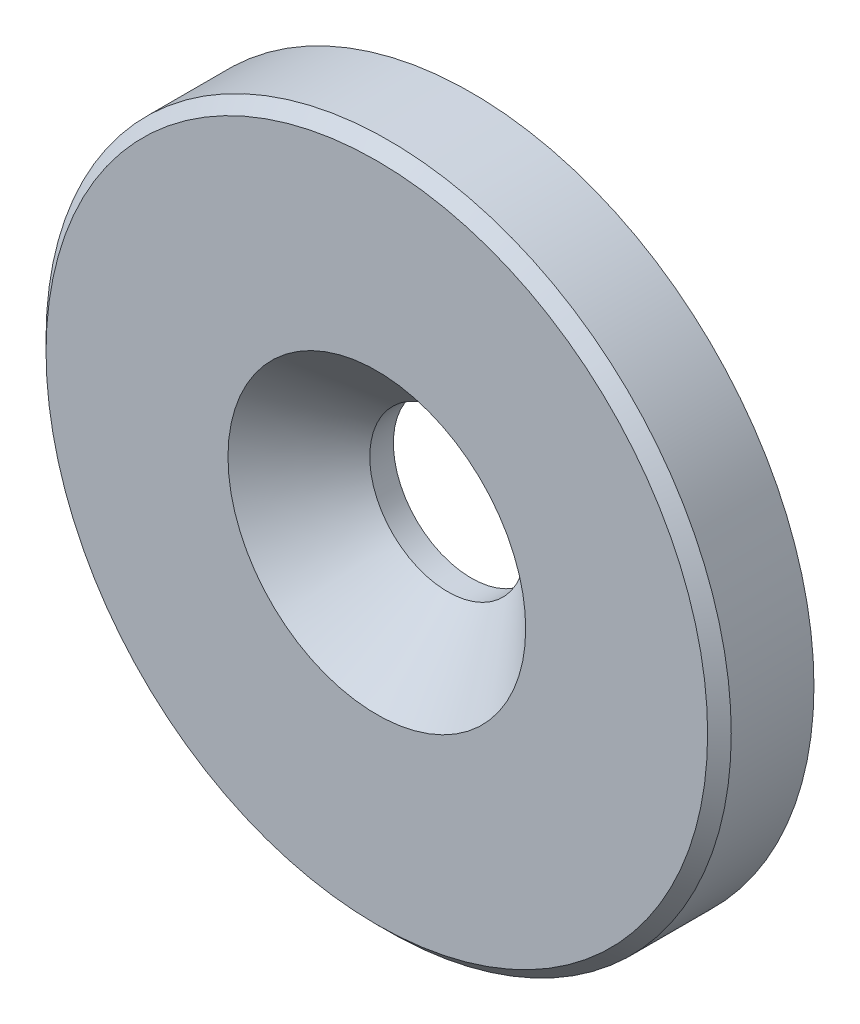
SolidWorks part; units mm, degrees
ref_plane "Plan1" through (0, 0, 0) normal (0, 0, 1) x (1, 0, 0)
ref_plane "Plan2" through (0, 0, 0) normal (0, 1, 0) x (1, 0, 0)
ref_plane "Plan3" through (0, 0, 0) normal (1, 0, 0) x (0, 0, -1)
sketch "Esquisse1" plane through (0, 0, 0) normal (0, 0, 1) x (1, 0, 0)
  circle A0 centre (0, 0) radius 14.5
  dimension "D1" = 29
extrude "Base-Extrusion" add sketch "Esquisse1" along normal blind 4
hole_wizard "Perçage1" positions "Esquisse3" profile "Esquisse2" legacy
sketch "Esquisse3" plane through (0, 0, 4) normal (0, 0, 1) x (1, 0, 0)
  point P0 (0, 0)
sketch "Esquisse2" plane through (0, 0, 4) normal (1, 0, 0) x (0, -1, 0)
  line L0 (0, 0) -> (0, 5.9828)
  line L1 (0, 5.9828) -> (3.3, 4)
  line L2 (3.3, 4) -> (3.3, 3)
  line L3 (3.3, 3) -> (6.3, 0)
  line L4 (6.3, 0) -> (0, 0)
  line L5 (0, -14.3089) -> (0, 102.4216) construction
  line L6 (0, 5.9828) -> (-3.3, 4) construction
  line L7 (-3.3, 3) -> (-6.3, 0) construction
  dimension "Diamètre" = 6.6
  dimension "Profondeur" = 4
  dimension "Diamètre fraisé" = 12.6
  dimension "Angle fraisé" = 90
  dimension "Angle" = 118
chamfer "Chanfrein1" distance 0.5 angle 45
